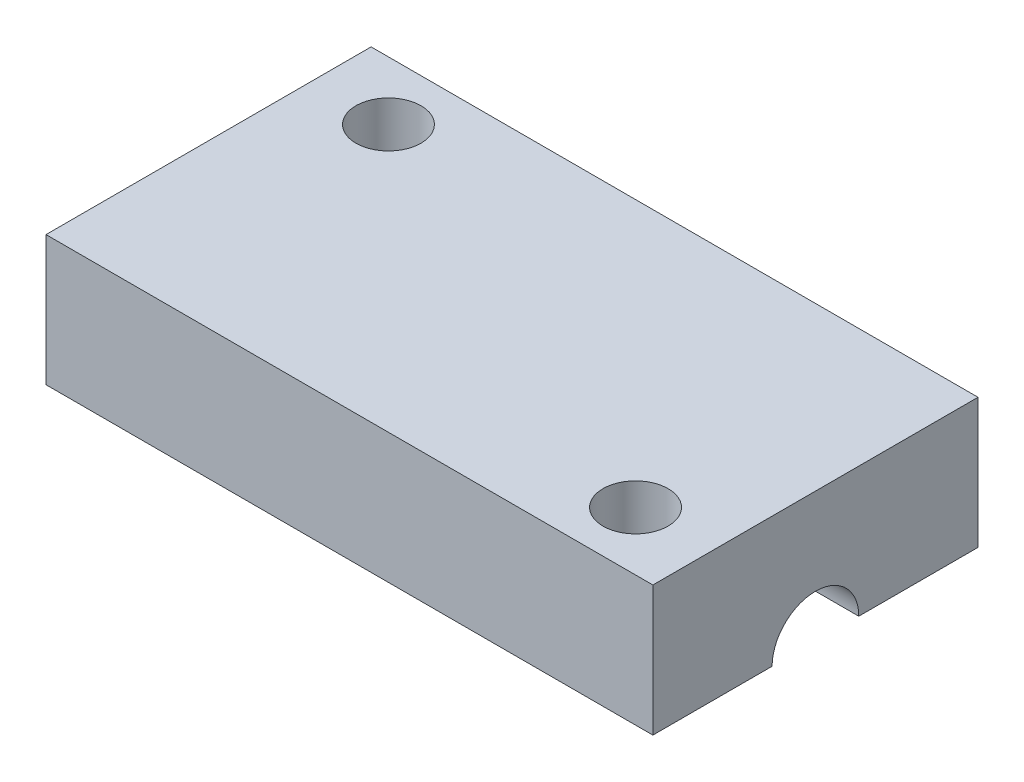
SolidWorks part; units mm, degrees
ref_plane "Plan de face" through (0, 0, 0) normal (0, 0, 1) x (1, 0, 0)
ref_plane "Plan de dessus" through (0, 0, 0) normal (0, 1, 0) x (1, 0, 0)
ref_plane "Plan de droite" through (0, 0, 0) normal (1, 0, 0) x (0, 0, -1)
sketch "Esquisse1" plane through (0, 0, 0) normal (1, 0, 0) x (0, 0, -1)
  line L0 (-7.5, 0) -> (-2, 0)
  line L1 (-7.5, 0) -> (-7.5, 6)
  line L2 (7.5, 0) -> (7.5, 6)
  line L3 (-7.5, 6) -> (7.5, 6)
  line L4 (2, 0) -> (7.5, 0)
  arc A0 (2, 0) -> (-2, 0) centre (0, 0) ccw
  point P7 (0, 0)
  dimension "D1" = 4
  dimension "D2" = 6
  dimension "D3" = 15
extrude "Boss.-Extru.1" add sketch "Esquisse1" along normal mid plane 28
sketch "Esquisse2" plane through (0, 6, 0) normal (0, 1, 0) x (1, 0, 0)
  line L0 (-10.5, 4.8) -> (10.5, -4.8) construction
  line L1 (14, 7.5) -> (-14, 7.5) construction
  line L2 (-14, 7.5) -> (-14, -7.5) construction
  circle A0 centre (-10.5, 4.8) radius 1.5
  circle A1 centre (10.5, -4.8) radius 1.5
  dimension "D1" = 3
  dimension "D2" = 3
  dimension "D3" = 2.7
  dimension "D4" = 3.5
extrude "Enlèv. mat.-Extru.1" cut sketch "Esquisse2" against normal through all
